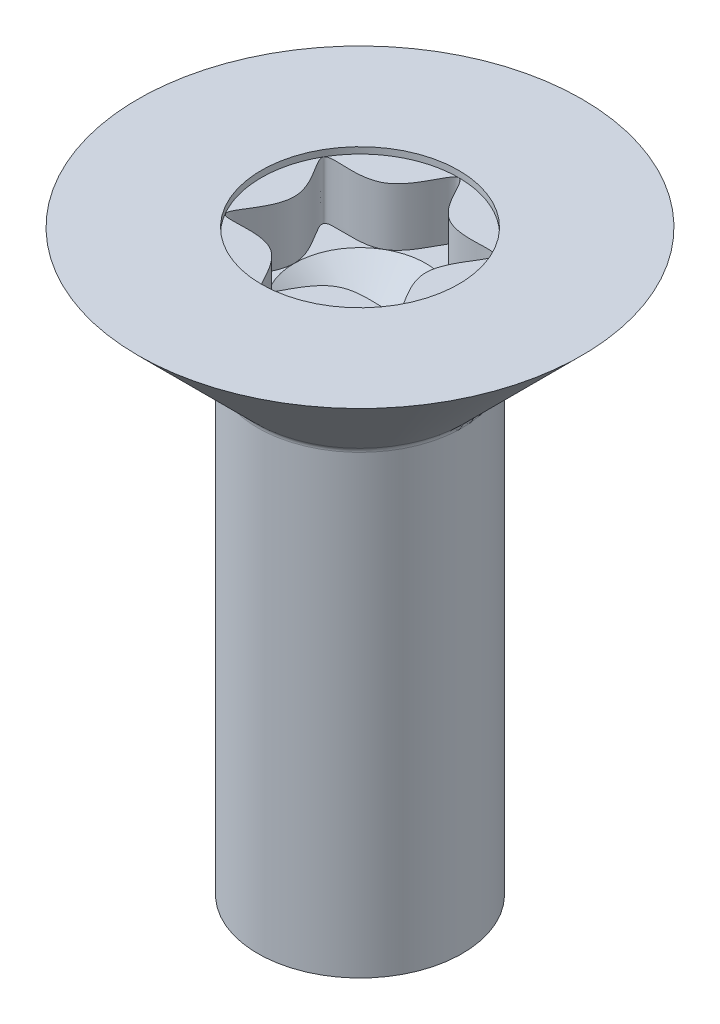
SolidWorks part; units mm, degrees
ref_plane "Front" through (0, 0, 0) normal (0, 0, 1) x (1, 0, 0)
ref_plane "Top" through (0, 0, 0) normal (0, 1, 0) x (1, 0, 0)
ref_plane "Right" through (0, 0, 0) normal (1, 0, 0) x (0, 0, -1)
sketch "Sketch1" plane through (0, 0, 0) normal (0, 0, 1) x (1, 0, 0)
  line L0 (0, 0) -> (0, 8.8882) construction
  line L1 (0, 8.2) -> (3.15, 8.2)
  line L2 (1.45, 0) -> (1.45, 6.5)
  line L3 (1.45, 6.5) -> (2.55, 6.5) construction
  line L4 (2.55, 6.5) -> (2.55, 5.4) construction
  line L5 (1.45, 0) -> (0, 0)
  line L6 (0, 0) -> (0, 8.2)
  line L7 (3.15, 8.2) -> (1.45, 6.5)
  dimension "D1" = 45
  dimension "head_dia" = 6.3
  dimension "head_ht" = 1.7
  dimension "length" = 8.2
  dimension "pitch" = 1.1
  dimension "thread_gap" = 1.1
revolve "Body-Revolve" add sketch "Sketch1" angle 360 about L0
sketch "Sketch2" plane through (0, 8.2, 0) normal (0, 1, 0) x (-1, 0, 0)
  line L0 (0, 0) -> (0, -1.54)
  line L1 (0, 0) -> (-0.7, -1.2124)
  circle A0 centre (0, 0) radius 1.4
  circle A1 centre (0, 0) radius 0.9333
  spline S0 degree 3 poles (0.302, -0.523) (0, -1.8385) (-0.302, -0.523) (-1.5922, -0.9193) (-0.6039, 0) (-1.5922, 0.9193) (-0.302, 0.523) (0, 1.8385) (0.302, 0.523) (1.5922, 0.9193) (0.6039, 0) (1.5922, -0.9193) (0.302, -0.523) (0, -1.8385) (-0.302, -0.523) knots -0.25 -0.166667 -0.083333 0 0.083333 0.166667 0.25 0.333333 0.416667 0.5 0.583333 0.666667 0.75 0.833333 0.916667 1 1.083333 1.166667 1.25 only from (0, -1.4) to (0, -1.4)
  point P4 (0, -1.4)
  point P7 (-0.4667, -0.8083)
  point P10 (-1.2124, -0.7)
  point P11 (-1.2124, 0.7)
  point P12 (0, 1.4)
  point P13 (1.2124, 0.7)
  point P14 (1.2124, -0.7)
  point P15 (-0.9333, 0)
  point P16 (-0.4667, 0.8083)
  point P17 (0.4667, 0.8083)
  point P18 (0.9333, 0)
  point P19 (0.4667, -0.8083)
  dimension "D1" = 1.8667
  dimension "socket_dia" = 2.8
  dimension "D2" = 30
  dimension "D3" = 1.54
extrude "Recess-Cut-Extrude1" cut sketch "Sketch2" against normal blind 0.91 contours S0
sketch "Sketch3" plane through (0, 8.2, 0) normal (0, 1, 0) x (-1, 0, 0)
  circle A0 centre (0, 0) radius 1.4
  dimension "D1" = 2.8
extrude "Recess-Cut-Extrude2" cut sketch "Sketch3" against normal blind 0.091
sketch "Sketch4" plane through (0, 0, 0) normal (0, 0, 1) x (1, 0, 0)
  line L0 (0, 7.29) -> (0.9333, 7.29)
  line L1 (1.2177, 7.29) -> (-1.2177, 7.29) construction
  line L2 (0.9333, 7.29) -> (0, 6.67)
  line L3 (0, 0) -> (0, 8.8882) construction
  line L4 (0, 6.67) -> (0, 7.29)
  line L5 (1.4, 8.2) -> (-1.4, 8.2) construction
  dimension "D1" = 1.53
  dimension "D2" = 0.9333
revolve "Drill-Cut-Revolve" cut sketch "Sketch4" angle 360 about axis through (0, 0, 0) along (0, 1, 0)
fillet "Fillet1" radius 0.1 1 edges at (0, 6.5, -1.45)
sketch "Sketch5" plane through (0, 0, 0) normal (0, 0, 1) x (1, 0, 0)
  line L0 (1.45, 5.4) -> (1.45, 4.7125)
  line L1 (1.45, 0) -> (1.45, 6.4586) construction
  line L2 (1.45, 4.7125) -> (0.8546, 5.0563)
  line L3 (0.8546, 5.0563) -> (1.45, 5.4)
  line L4 (0, 0) -> (0, 8.8882) construction
  line L5 (-1.45, 0) -> (1.45, 0) construction
  dimension "D1" = 0.8546
  dimension "D2" = 5.4
revolve "ThreadSchematic" [suppressed] cut sketch "Sketch5" angle 360 about axis through (0, 0, 0) along (0, 1, 0)
pattern_linear "ThdSchPat" [suppressed] count 5 spacing 1.1 along (0, 1, 0)
sketch "Sketch6" plane through (0, 0, 0) normal (0, 0, 1) x (1, 0, 0)
  line L0 (0.01, 0) -> (1.45, 0)
  line L1 (-1.45, 0) -> (1.45, 0) construction
  line L2 (1.45, 0) -> (1.45, 2.6)
  line L4 (1.45, 2.6) -> (0.01, 0)
  line L5 (0, 0) -> (0, 8.8882) construction
  dimension "D1" = 1.45
  dimension "D2" = 0.01
  dimension "end_lengthC" = 2.6
revolve "TypeC" [suppressed] cut sketch "Sketch6" angle 360 about axis through (0, 0, 0) along (0, 1, 0)
sketch "Sketch7" plane through (0, 0, 0) normal (0, 0, 1) x (1, 0, 0)
  line L0 (1.2293, 0) -> (1.45, 0)
  line L1 (0, 0) -> (0, 8.8882) construction
  line L2 (1.45, 0) -> (1.45, 2.1)
  line L4 (1.45, 2.1) -> (1.2293, 0)
  line L5 (-1.45, 0) -> (1.45, 0) construction
  dimension "D1" = 6
  dimension "end_lengthF" = 2.1
  dimension "D2" = 1.45
revolve "TypeF" [suppressed] cut sketch "Sketch7" angle 360 about axis through (0, 0, 0) along (0, 1, 0)
sketch "Sketch8" plane through (0, 0, 0) normal (0, 0, 1) x (1, 0, 0)
  line L0 (1.45, -0.09) -> (1.45, 2)
  line L2 (1.45, 2) -> (0.1163, 0.0456)
  line L3 (0.03, 0) -> (0.03, -0.09)
  line L4 (0.03, -0.09) -> (1.45, -0.09)
  line L5 (0, 0) -> (0, 8.8882) construction
  line L9 (-1.45, 0) -> (1.45, 0) construction
  arc A0 (0.1163, 0.0456) -> (0.03, 0) centre (0.03, 0.1045) cw
  dimension "D4" = 0.1045
  dimension "D1" = 0.09
  dimension "D2" = 0.03
  dimension "D3" = 1.45
  dimension "end_lengthR" = 2.09
revolve "TypeR" [suppressed] cut sketch "Sketch8" angle 360 about axis through (0, 0, 0) along (0, 1, 0)
equation "\"thread_gap@Sketch1\" = \"pitch@Sketch1\""
equation "\"D1@ThreadCosmetic\" = \"length@Sketch1\" - \"head_ht@Sketch1\" - \"thread_gap@Sketch1\""
equation "\"D2@ThreadCosmetic\" = \"head_dia@Sketch1\" - \"head_ht@Sketch1\" * 2 - 1.0825 * \"pitch@Sketch1\""
equation "\"D1@Sketch2\" = \"socket_dia@Sketch2\" / 1.5"
equation "\"D3@Sketch2\" = \"socket_dia@Sketch2\" / 2 * 1.1"
equation "\"D1@Sketch3\" = \"socket_dia@Sketch2\""
equation "\"D1@Recess-Cut-Extrude2\" = 0.1 * \"socket-dep@Recess-Cut-Extrude1\""
equation "\"D1@Sketch4\" = 0.9*\"head_ht@Sketch1\""
equation "\"D2@Sketch4\" = \"D1@Sketch2\" / 2"
equation "\"D1@Sketch5\" = \"D2@ThreadCosmetic\" / 2"
equation "\"D2@Sketch5\" = \"D1@ThreadCosmetic\""
equation "\"D3@ThdSchPat\" = \"pitch@Sketch1\""
equation "\"D1@ThdSchPat\" = \"D1@ThreadCosmetic\" / \"D3@ThdSchPat\""
equation "\"D1@Sketch6\" = \"head_dia@Sketch1\" / 2 - \"head_ht@Sketch1\""
equation "\"D2@Sketch7\" = \"head_dia@Sketch1\" / 2 - \"head_ht@Sketch1\""
equation "\"D3@Sketch8\" = \"head_dia@Sketch1\" * 0.5 - \"head_ht@Sketch1\""
equation "\"D4@Sketch8\" = \"end_lengthR@Sketch8\" / 20"
